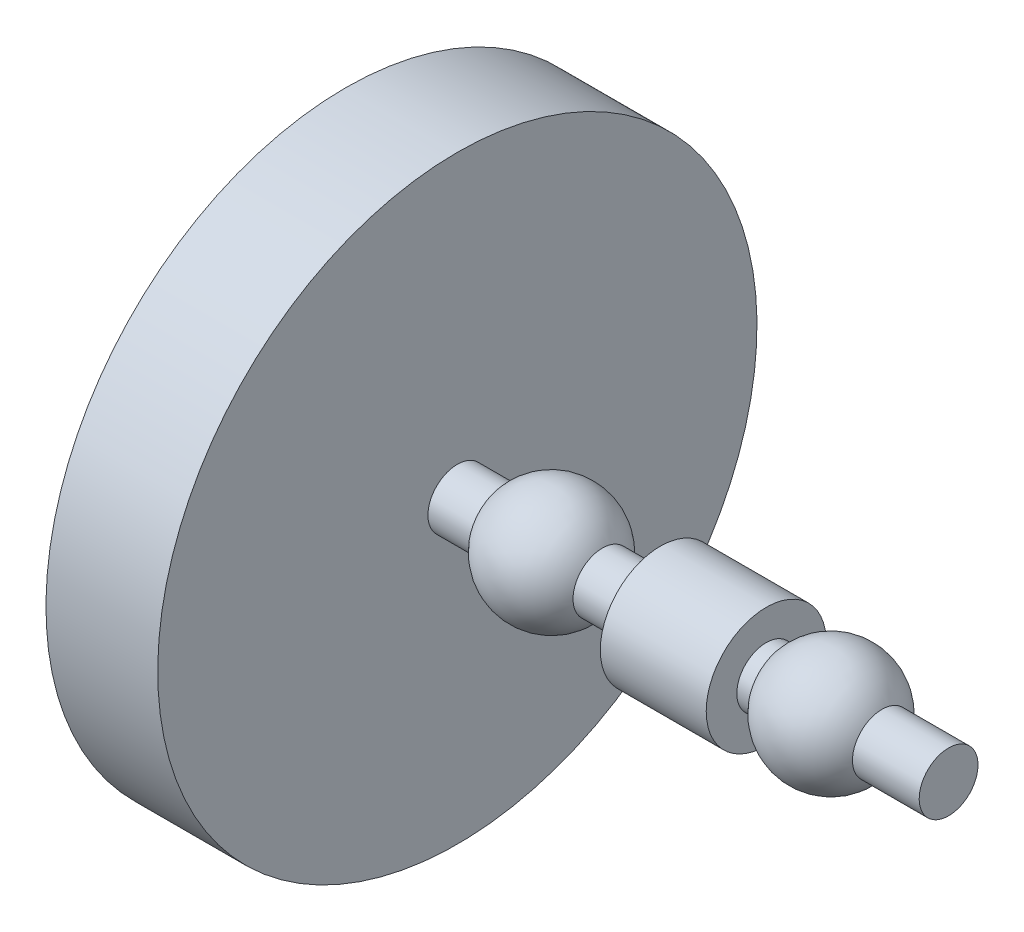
SolidWorks part; units mm, degrees
ref_plane "Plan de face" through (0, 0, 0) normal (0, 0, 1) x (1, 0, 0)
ref_plane "Plan de dessus" through (0, 0, 0) normal (0, 1, 0) x (1, 0, 0)
ref_plane "Plan de droite" through (0, 0, 0) normal (1, 0, 0) x (0, 0, -1)
sketch "Esquisse1" plane through (0, 0, 0) normal (0, 0, 1) x (1, 0, 0)
  line L1 (0, 0) -> (47.5, 0) construction
  line L3 (8.6603, 5) -> (38.8397, 5)
  line L4 (0, 0) -> (47.5, 0)
  line L5 (0, 0) -> (-55.3191, 0) construction
  line L6 (0, 0) -> (-35, 0)
  line L8 (-8.6603, 5) -> (-16, 5)
  line L9 (47.5, 0) -> (67.5, 0)
  line L10 (-35, 0) -> (-35, 50.93)
  line L11 (-35, 50.93) -> (-16, 50.93)
  line L12 (-16, 5) -> (-16, 50.93)
  line L14 (56.1603, 5) -> (67.5, 5)
  line L15 (67.5, 0) -> (67.5, 5)
  arc A0 (8.6603, 5) -> (-8.6603, 5) centre (0, 0) ccw
  arc A1 (56.1603, 5) -> (38.8397, 5) centre (47.5, 0) ccw
  dimension "D1" = 10
  dimension "D2" = 10
  dimension "D3" = 47.5
  dimension "D4" = 5
  dimension "D5" = 35
  dimension "D6" = 19
  dimension "D7" = 101.86
  dimension "D8" = 20
revolve "Révolution2" add sketch "Esquisse1" angle 360 about L5
sketch "Esquisse2" plane through (0, 0, 0) normal (0, 0, 1) x (1, 0, 0)
  line L0 (0, 0) -> (77.9617, 0) construction
  line L1 (18.5, 0) -> (36.5, 0)
  line L2 (18.5, 0) -> (18.5, 10.2)
  line L3 (18.5, 10.2) -> (36.5, 10.2)
  line L4 (36.5, 0) -> (36.5, 10.2)
  dimension "D1" = 18.5
  dimension "D2" = 18
  dimension "D3" = 20.4
revolve "Révolution3" add sketch "Esquisse2" angle 360 about L0
sketch "Esquisse3" plane through (-35, 0, 0) normal (-1, 0, 0) x (0, 0, 1)
  line L0 (0, 0) -> (55.062, 0) construction
  line L1 (40, 3) -> (9, 3)
  line L2 (42, 1) -> (42, -1)
  line L3 (40, -3) -> (9, -3)
  line L4 (7, 1) -> (7, -1)
  arc A0 (42, -1) -> (40, -3) centre (40, -1) cw
  arc A1 (40, 3) -> (42, 1) centre (40, 1) cw
  arc A2 (7, 1) -> (9, 3) centre (9, 1) cw
  arc A3 (9, -3) -> (7, -1) centre (9, -1) cw
  dimension "D1" = 2
  dimension "D2" = 6
  dimension "D3" = 35
  dimension "D4" = 7
extrude "Enlèv. mat.-Extru.1" cut sketch "Esquisse3" against normal blind 3
